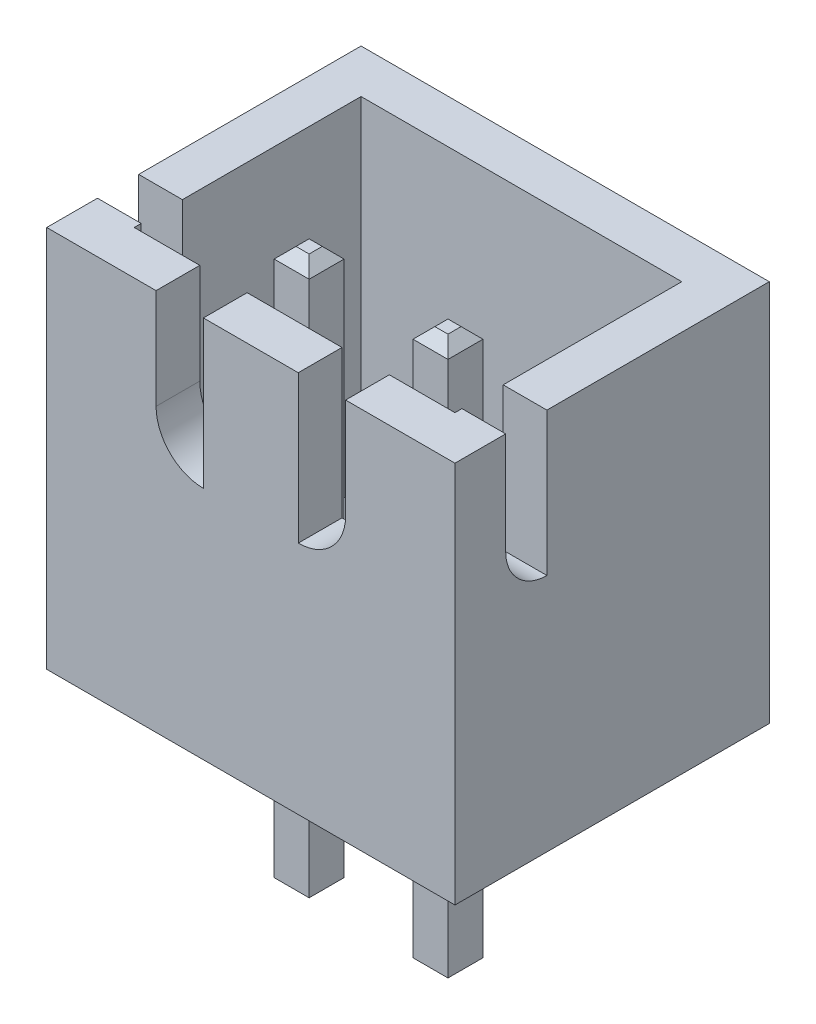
SolidWorks part; units mm, degrees
other "Camera1"
ref_plane "Front Plane" through (0, 0, 0) normal (0, 0, 1) x (1, 0, 0)
ref_plane "Top Plane" through (0, 0, 0) normal (0, 1, 0) x (1, 0, 0)
ref_plane "Right Plane" through (0, 0, 0) normal (1, 0, 0) x (0, 0, -1)
sketch "Sketch1" plane through (0, 0, 0) normal (0, 1, 0) x (1, 0, 0)
  line L1 (-3.7338, 2.875) -> (3.7338, 2.875)
  line L2 (-3.7338, 2.875) -> (-3.7338, -2.875)
  line L3 (-3.7338, -2.875) -> (3.7338, -2.875)
  line L4 (3.7338, 2.875) -> (3.7338, -2.875)
  line L5 (-3.7338, 2.875) -> (3.7338, -2.875) construction
  line L6 (-3.7338, -2.875) -> (3.7338, 2.875) construction
  point P0 (0, 0)
  dimension "D1" = 5.75
  dimension "D2" = 7.4676
extrude "Boss-Extrude1" add sketch "Sketch1" along normal blind 7
shell "Shell1" thickness 0.8
sketch "Sketch2" plane through (3.7338, 0, 0) normal (1, 0, 0) x (0, 0, -1)
  line L0 (-1.193, 7) -> (-1.193, 4.3796)
  line L1 (-2.875, 7) -> (2.875, 7) construction
  line L2 (-1.9469, 5.1335) -> (-1.9469, 7)
  line L3 (-1.9469, 7) -> (-1.193, 7)
  arc A0 (-1.193, 4.3796) -> (-1.9469, 5.1335) centre (-1.193, 5.1335) cw
extrude "Cut-Extrude1" cut sketch "Sketch2" against normal through all
sketch "Sketch3" plane through (0, 0, 2.875) normal (0, 0, 1) x (1, 0, 0)
  line L0 (-1.7338, 7) -> (-1.7338, 6.7289)
  line L1 (-3.7338, 7) -> (3.7338, 7) construction
  line L4 (-1.7338, 6.7289) -> (-1.7338, 5.1663)
  line L5 (-0.8676, 4.3001) -> (-0.8676, 7)
  line L6 (-0.8676, 7) -> (-1.7338, 7)
  line L7 (-3.7338, 7) -> (-3.7338, 0) construction
  line L8 (0, 7) -> (0, 0) construction
  line L9 (0.8676, 7) -> (1.7338, 7)
  line L10 (0.8676, 4.3001) -> (0.8676, 7)
  line L11 (1.7338, 6.7289) -> (1.7338, 5.1663)
  line L14 (1.7338, 7) -> (1.7338, 6.7289)
  arc A0 (-1.7338, 5.1663) -> (-0.8676, 4.3001) centre (-0.8676, 5.1663) ccw
  arc A1 (1.7338, 5.1663) -> (0.8676, 4.3001) centre (0.8676, 5.1663) cw
  dimension "D1" = 2
extrude "Cut-Extrude2" cut sketch "Sketch3" against normal up to next
sketch "Sketch4" plane through (0, 0, 0) normal (0, -1, 0) x (1, 0, 0)
  line L0 (-3.7338, -2.875) -> (-3.7338, 2.875) construction
  line L1 (-1.6038, 0.845) -> (-0.9638, 0.845)
  line L2 (-1.6038, 0.845) -> (-1.6038, 0.205)
  line L3 (-1.6038, 0.205) -> (-0.9638, 0.205)
  line L4 (-0.9638, 0.845) -> (-0.9638, 0.205)
  line L5 (-1.6038, 0.845) -> (-0.9638, 0.205) construction
  line L6 (-1.6038, 0.205) -> (-0.9638, 0.845) construction
  line L9 (-3.7338, 2.875) -> (3.7338, 2.875) construction
  line L10 (0.9362, 0.845) -> (1.5762, 0.845)
  line L11 (1.5762, 0.845) -> (1.5762, 0.205)
  line L12 (0.9362, 0.205) -> (1.5762, 0.205)
  line L13 (0.9362, 0.845) -> (0.9362, 0.205)
  line L22 (6.0162, 0.845) -> (6.6562, 0.845)
  line L23 (6.6562, 0.845) -> (6.6562, 0.205)
  line L24 (6.0162, 0.205) -> (6.6562, 0.205)
  line L25 (6.0162, 0.845) -> (6.0162, 0.205)
  line L26 (3.4762, 0.845) -> (4.1162, 0.845)
  line L27 (4.1162, 0.845) -> (4.1162, 0.205)
  line L28 (3.4762, 0.205) -> (4.1162, 0.205)
  line L29 (3.4762, 0.845) -> (3.4762, 0.205)
  point P0 (-1.2838, 0.525)
  dimension "D1" = 0.64
  dimension "D3" = 2.45
  dimension "D4" = 2.35
  dimension "D5" = 4
extrude "Boss-Extrude2" add sketch "Sketch4" along normal blind 3.45 and the other way blind 6.75
chamfer "Chamfer1" distance 0.2 angle 45 16 edges at (0.9362, -3.45, 0.525) (1.2562, -3.45, 0.845) (1.5762, -3.45, 0.525) (1.2562, -3.45, 0.205) (-1.2838, -3.45, 0.205) (-1.6038, -3.45, 0.525) (-1.2838, -3.45, 0.845) (-0.9638, -3.45, 0.525) (1.5762, 6.75, 0.525) (1.2562, 6.75, 0.845) (0.9362, 6.75, 0.525) (1.2562, 6.75, 0.205) (-1.2838, 6.75, 0.845) (-1.6038, 6.75, 0.525) (-1.2838, 6.75, 0.205) (-0.9638, 6.75, 0.525)
